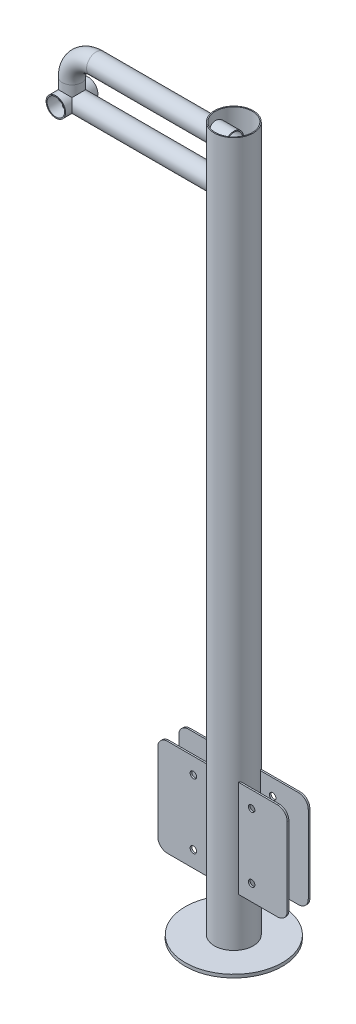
SolidWorks part; units mm, degrees
ref_plane "Plan de face" through (0, 0, 0) normal (0, 0, 1) x (1, 0, 0)
ref_plane "Plan de dessus" through (0, 0, 0) normal (0, 1, 0) x (1, 0, 0)
ref_plane "Plan de droite" through (0, 0, 0) normal (1, 0, 0) x (0, 0, -1)
sketch "Esquisse1" plane through (0, 0, 0) normal (0, 1, 0) x (1, 0, 0)
  circle A0 centre (0, 0) radius 150
  dimension "D1" = 300
extrude "Boss.-Extru.1" add sketch "Esquisse1" along normal blind 10
sketch "Esquisse2" plane through (0, 10, 0) normal (0, 1, 0) x (1, 0, 0)
  circle A0 centre (0, 0) radius 60
  circle A1 centre (0, 0) radius 57
  dimension "D1" = 120
  dimension "D2" = 3
extrude "Boss.-Extru.2" add sketch "Esquisse2" along normal blind 2175
ref_plane "Plan1" through (0, 310, 0) normal (0, 1, 0) x (-1, 0, 0)
sketch "Esquisse3" plane through (0, 310, 0) normal (0, 1, 0) x (-1, 0, 0)
  line L0 (-51.9615, -30) -> (-200, -30)
  line L1 (200, -35) -> (48.734, -35)
  line L2 (200, -35) -> (200, -30)
  line L3 (200, -30) -> (51.9615, -30)
  line L4 (-200, -35) -> (-200, -30)
  line L5 (-48.734, -35) -> (-200, -35)
  circle A0 centre (0, 0) radius 60 construction
  arc A1 (48.734, -35) -> (51.9615, -30) centre (0, 0) ccw
  arc A2 (-51.9615, -30) -> (-48.734, -35) centre (0, 0) ccw
  dimension "D1" = 200
  dimension "D2" = 5
  dimension "D3" = 30
extrude "Boss.-Extru.3" add sketch "Esquisse3" along normal mid plane 300
fillet "Congé1" radius 30 4 edges at (200, 460, -32.5) (200, 160, -32.5) (-200, 160, -32.5) (-200, 460, -32.5)
mirror "Symétrie1" about plane through (0, 0, 0) normal (0, 0, 1) of "Congé1", "Boss.-Extru.3"
sketch "Esquisse4" plane through (0, 0, -35) normal (0, 0, -1) x (-1, 0, 0)
  line L1 (165, 310) -> (-165, 310) construction
  circle A0 centre (-90, 410) radius 10
  dimension "D2" = 20
  dimension "D1" = 100
  dimension "D3" = 90
extrude "Enlèv. mat.-Extru.1" cut sketch "Esquisse4" against normal through all
mirror "Symétrie2" about plane through (0, 310, 0) normal (0, 1, 0) of "Enlèv. mat.-Extru.1"
mirror "Symétrie3" about plane through (0, 0, 0) normal (1, 0, 0) of "Symétrie2", "Enlèv. mat.-Extru.1"
sketch "Esquisse5" plane through (0, 0, 0) normal (0, 0, 1) x (1, 0, 0)
  circle A0 centre (-500, 2000) radius 30
  circle A1 centre (-500, 2000) radius 27
  dimension "D1" = 60
  dimension "D2" = 3
  dimension "D3" = 500
  dimension "D4" = 2000
extrude "Boss.-Extru.4" add sketch "Esquisse5" along normal mid plane 100 separate body
sketch "Esquisse6" plane through (0, 0, 0) normal (0, 0, 1) x (1, 0, 0)
  line L0 (0, 2130) -> (-425, 2130)
  line L1 (-500, 2055) -> (-500, 2000)
  line L2 (0, -165) -> (0, 165) construction
  arc A0 (-425, 2130) -> (-500, 2055) centre (-425, 2055) ccw
  dimension "D1" = 75
  dimension "D2" = 130
sketch "Esquisse7" plane through (0, 0, 0) normal (1, 0, 0) x (0, 0, -1)
  circle A0 centre (0, 2130) radius 30
  circle A1 centre (0, 2130) radius 27
  dimension "D1" = 60
  dimension "D2" = 3
sweep "Balayage2" add profiles "Esquisse7" path "Esquisse6"
sketch "Esquisse8" plane through (0, 0, 0) normal (1, 0, 0) x (0, 0, -1)
  line L0 (-50, 2000) -> (50, 2000) construction
  circle A0 centre (0, 2000) radius 30
  circle A1 centre (0, 2130) radius 30 construction
  circle A2 centre (0, 2000) radius 27
  circle A3 centre (0, 2130) radius 27 construction
sketch "Esquisse9" plane through (0, 0, 0) normal (0, 0, 1) x (1, 0, 0)
  line L0 (0, 2000) -> (-500, 2000)
  line L1 (0, 1970) -> (0, 2030) construction
  line L2 (-527, 2000) -> (-473, 2000) construction
sweep "Balayage3" add profiles "Esquisse8" path "Esquisse9"
